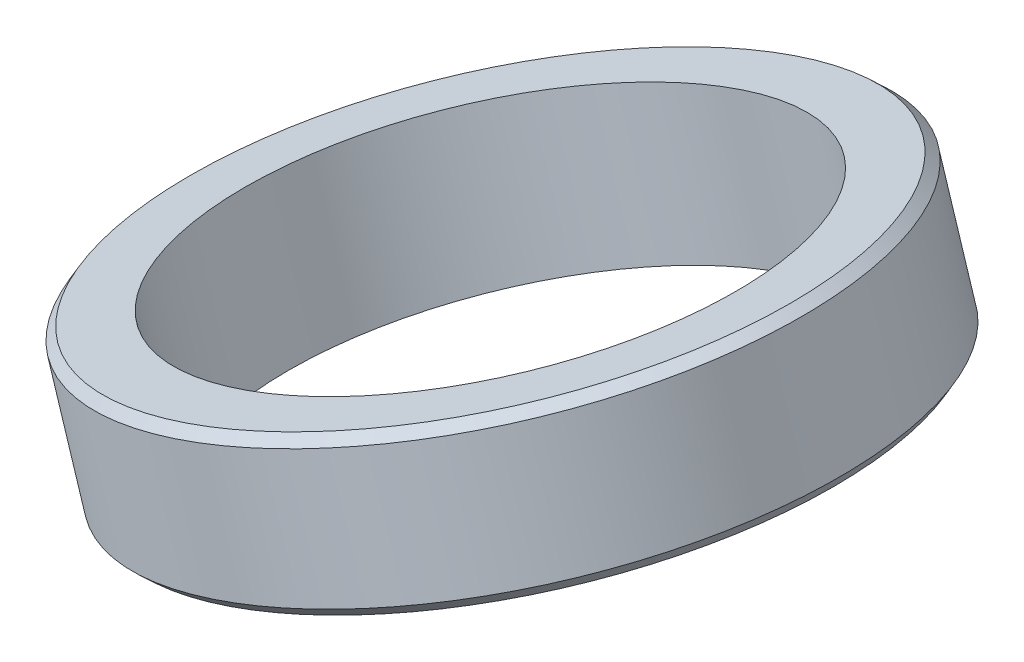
SolidWorks part; units mm, degrees
ref_plane "Alzado" through (0, 0, 0) normal (0, 0, 1) x (1, 0, 0)
ref_plane "Planta" through (0, 0, 0) normal (0, 1, 0) x (1, 0, 0)
ref_plane "Vista lateral" through (0, 0, 0) normal (1, 0, 0) x (0, 0, -1)
sketch "Sk_Contratuerca" plane through (0, 0, 0) normal (0, 0, 1) x (1, 0, 0)
  line L0 (370.4131, 564.5802) -> (373.465, 565.5425)
  line L1 (373.465, 565.5425) -> (374.0922, 565.216)
  line L2 (374.0922, 565.216) -> (376.1972, 558.54)
  line L3 (376.1972, 558.54) -> (375.8707, 557.9128)
  line L4 (375.8707, 557.9128) -> (372.8188, 556.9505)
  line L5 (372.8188, 556.9505) -> (370.4131, 564.5802)
  line L6 (355.2714, 565.0486) -> (365.7964, 531.6686) construction
revolve "Contratuerca" add sketch "Sk_Contratuerca" angle 360 about L6
